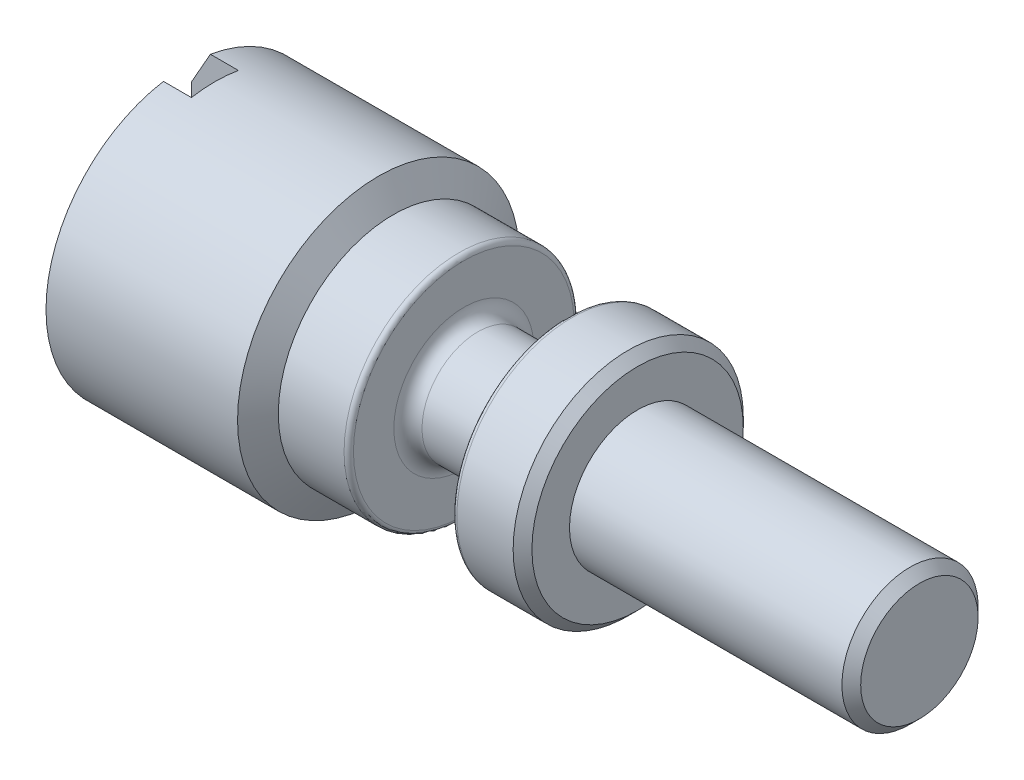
SolidWorks part; units mm, degrees
ref_plane "Plan1" through (0, 0, 0) normal (0, 0, 1) x (1, 0, 0)
ref_plane "Plan2" through (0, 0, 0) normal (0, 1, 0) x (1, 0, 0)
ref_plane "Plan3" through (0, 0, 0) normal (1, 0, 0) x (0, 0, -1)
sketch "Esquisse1" plane through (0, 0, 0) normal (0, 0, 1) x (1, 0, 0)
  line L0 (-5.455, 0) -> (26.7145, 0) construction
  line L1 (0, 2.3) -> (0, 0)
  line L2 (0, 0) -> (16, 0)
  line L3 (10, 1.45) -> (10, 2.45)
  line L4 (10, 2.45) -> (8.5, 2.45)
  line L5 (8.5, 2.45) -> (8.5, 1.19)
  line L6 (8.5, 1.19) -> (6.3, 1.19)
  line L7 (6.3, 1.19) -> (6.3, 2.45)
  line L8 (6.3, 2.45) -> (4.8, 2.45)
  line L9 (3.3, 0) -> (-3.3, 0) construction
  line L10 (0, -3.3) -> (0, 3.3) construction
  line L11 (4.8, 2.45) -> (4.4825, 3)
  line L12 (4.4825, 3) -> (0.4041, 3)
  line L13 (0.4041, 3) -> (0, 2.3)
  line L14 (10, 1.45) -> (16, 1.45)
  line L15 (16, 1.45) -> (16, 0)
  circle A0 centre (7.1, 1.9) radius 0.8 construction
  dimension "D6" = 2.2
  dimension "D7" = 1.6
  dimension "D1" = 1.26
  dimension "D2" = 4.9
  dimension "D3" = 1.5
  dimension "D4" = 2.2
  dimension "D5" = 10
  dimension "D8" = 6
  dimension "D9" = 30
  dimension "D10" = 30
  dimension "D11" = 0.7
  dimension "D12" = 1.5
  dimension "D13" = 4.8
  dimension "D14" = 2.9
  dimension "D15" = 6
revolve "Révolution1" add sketch "Esquisse1" angle 360 about L0
chamfer "Chanfrein1" distance 0.2 angle 45 2 edges at (10, 0, 2.45) (16, 0, 1.45)
fillet "Congé1" radius 0.3 2 edges at (6.3, 0, 1.19) (8.5, 0, 1.19)
sketch "Esquisse2" plane through (0, 0, 0) normal (0, 0, 1) x (1, 0, 0)
  line L0 (-5.455, 0) -> (26.7145, 0) construction
  line L1 (-5.455, 0) -> (26.7145, 0) construction
  circle A0 centre (7.1, 1.9) radius 0.8 construction
  circle A1 centre (7.1, 1.9) radius 0.8
revolve "Révolution2" add sketch "Esquisse2" angle 360 about L1
sketch "Esquisse3" plane through (0, 0, 0) normal (-1, 0, 0) x (0, 0, 1)
  line L1 (1.7321, 0) -> (0.866, 1.5)
  line L2 (0.866, 1.5) -> (-0.866, 1.5)
  line L3 (-0.866, 1.5) -> (-1.7321, 0)
  line L4 (-1.7321, 0) -> (-0.866, -1.5)
  line L5 (-0.866, -1.5) -> (0.866, -1.5)
  line L6 (0.866, -1.5) -> (1.7321, 0)
  circle A0 centre (0, 0) radius 1.5 construction
  dimension "D1" = 3
extrude "Enlèv. mat.-Extru.1" [suppressed] cut sketch "Esquisse3" against normal blind 2
sketch "Esquisse4" plane through (0, 0, 0) normal (0, 1, 0) x (1, 0, 0)
  line L1 (0, 0.5) -> (1, 0.5)
  line L2 (0, 0.5) -> (0, -0.5)
  line L3 (0, -0.5) -> (1, -0.5)
  line L4 (1, 0.5) -> (1, -0.5)
  dimension "D1" = 1
  dimension "D2" = 1
extrude "Enlèv. mat.-Extru.2" cut sketch "Esquisse4" against normal mid plane 9
delete or keep bodies "Corps-Effacer/suppr1" type delete bodies bodies 102
fillet "Congé2" radius 0.1 2 edges at (6.3, 0, 2.45) (8.5, 0, 2.45)
